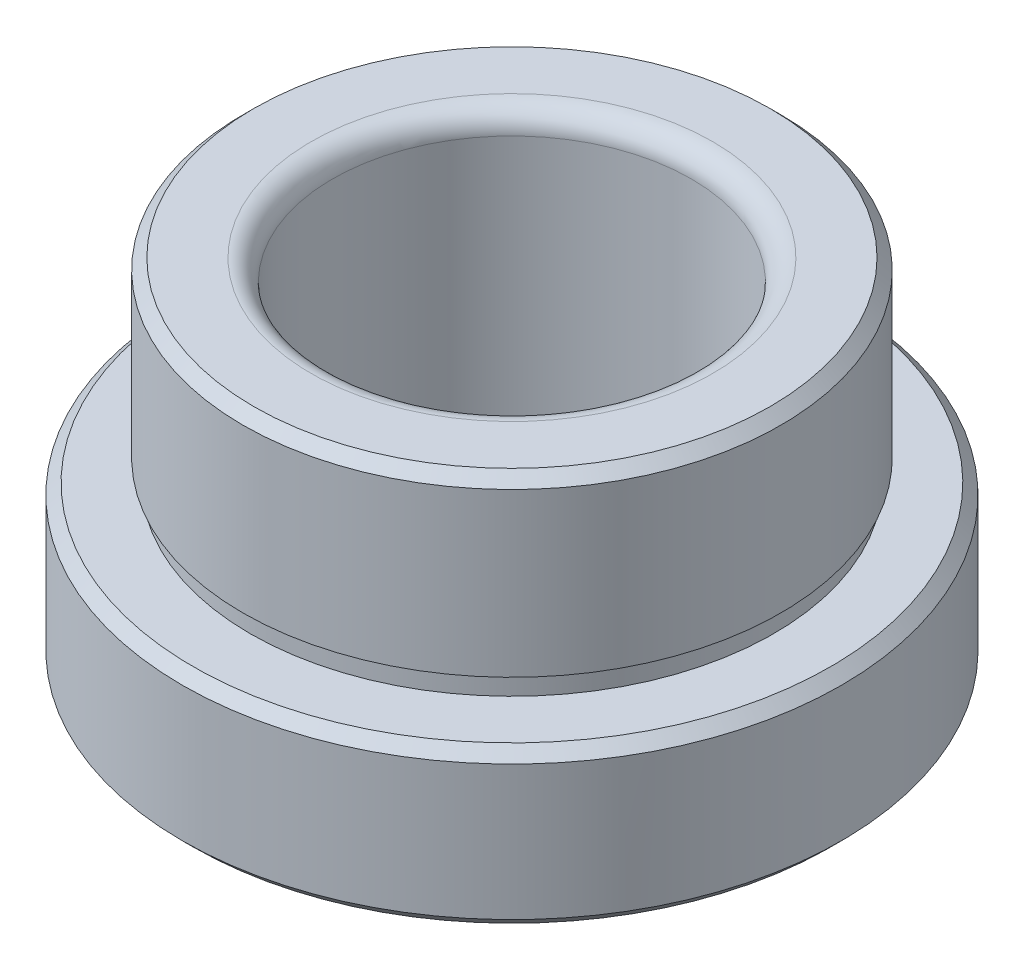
SolidWorks part; units mm, degrees
ref_plane "Front Plane" through (0, 0, 0) normal (0, 0, 1) x (1, 0, 0)
ref_plane "Top Plane" through (0, 0, 0) normal (0, 1, 0) x (1, 0, 0)
ref_plane "Right Plane" through (0, 0, 0) normal (1, 0, 0) x (0, 0, -1)
sketch "Sketch1" plane through (0, 0, 0) normal (0, 0, 1) x (1, 0, 0)
  line L0 (0, 10.519) -> (0, 0) construction
  line L1 (6.3576, 12.446) -> (6.3576, 0)
  line L2 (6.3576, 12.446) -> (9.5339, 12.446)
  line L3 (9.5339, 12.446) -> (9.5339, 6.2992)
  line L4 (9.5339, 6.2992) -> (9.2799, 6.2992)
  line L5 (9.2799, 6.2992) -> (9.2799, 5.5372)
  line L6 (9.2799, 5.5372) -> (11.684, 5.5372)
  line L7 (11.684, 5.5372) -> (11.684, 0)
  line L8 (11.684, 0) -> (6.3576, 0)
  dimension "D1" = 19.0678
  dimension "D2" = 0.254
  dimension "D3" = 0.762
  dimension "D4" = 23.368
  dimension "D5" = 12.7152
  dimension "D6" = 5.5372
  dimension "D7" = 12.446
revolve "Revolve1" add sketch "Sketch1" angle 360 about L0
fillet "Fillet1" radius 0.762 1 edges at (0, 12.446, 6.3576)
chamfer "Chamfer1" distance 0.762 angle 45 1 edges at (0, 0, 6.3576)
chamfer "Chamfer2" distance 0.381 angle 45 3 edges at (0, 0, 11.684) (0, 5.5372, 11.684) (0, 12.446, 9.5339)
